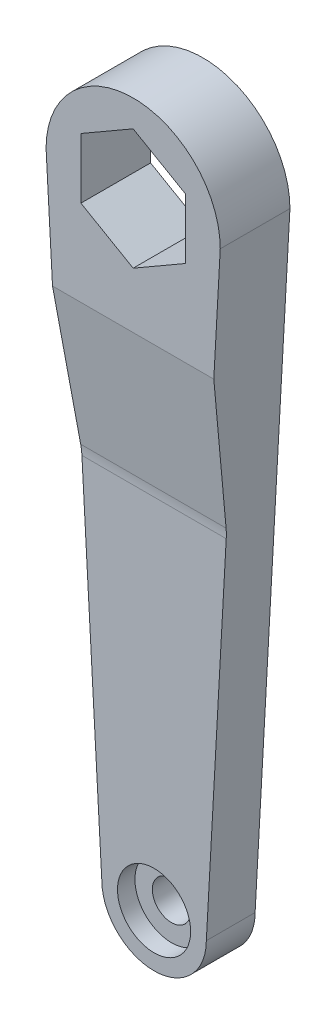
SolidWorks part; units mm, degrees
ref_plane "Plan de face" through (0, 0, 0) normal (0, 0, 1) x (1, 0, 0)
ref_plane "Plan de dessus" through (0, 0, 0) normal (0, 1, 0) x (1, 0, 0)
ref_plane "Plan de droite" through (0, 0, 0) normal (1, 0, 0) x (0, 0, -1)
sketch "Esquisse1" plane through (0, 0, 0) normal (0, 0, 1) x (1, 0, 0)
  line L0 (-12.5, 0) -> (-7.5, -90)
  line L1 (12.5, 0) -> (7.5, -90)
  line L3 (7.5, 4.3301) -> (0, 8.6603)
  line L4 (0, 8.6603) -> (-7.5, 4.3301)
  line L5 (-7.5, 4.3301) -> (-7.5, -4.3301)
  line L6 (-7.5, -4.3301) -> (0, -8.6603)
  line L7 (0, -8.6603) -> (7.5, -4.3301)
  line L8 (7.5, -4.3301) -> (7.5, 4.3301)
  arc A0 (12.5, 0) -> (-12.5, 0) centre (0, 0) ccw
  arc A1 (-7.5, -90) -> (7.5, -90) centre (0, -90) ccw
  circle A2 centre (0, 0) radius 7.5 construction
  circle A3 centre (0, -90) radius 2.75
  point P1 (7.5, 0)
  dimension "D2" = 25
  dimension "D3" = 15
  dimension "D5" = 5.5
  dimension "D1" = 90
  dimension "D4" = 15
extrude "Boss.-Extru.1" add sketch "Esquisse1" along normal blind 10
sketch "Esquisse2" plane through (0, 0, 0) normal (1, 0, 0) x (0, 0, -1)
  line L0 (-7, -117.102) -> (-7, -37.9025)
  line L1 (-7, -37.9025) -> (-11.9864, -2.5959)
  line L2 (-11.9864, -2.5959) -> (-24.582, -2.5959)
  line L3 (-24.582, -2.5959) -> (-24.582, -117.102)
  line L4 (-24.582, -117.102) -> (-7, -117.102)
  line L5 (0, -90) -> (0, 0) construction
  dimension "D1" = 7
extrude "Enlèv. mat.-Extru.1" cut sketch "Esquisse2" against normal through all and the other way through all
sketch "Esquisse3" plane through (0, 0, 7) normal (0, 0, 1) x (1, 0, 0)
  line L1 (0, -94.7343) -> (4.1, -92.3671)
  line L2 (4.1, -92.3671) -> (4.1, -87.6329)
  line L3 (4.1, -87.6329) -> (0, -85.2657)
  line L4 (0, -85.2657) -> (-4.1, -87.6329)
  line L5 (-4.1, -87.6329) -> (-4.1, -92.3671)
  line L6 (-4.1, -92.3671) -> (0, -94.7343)
  circle A0 centre (0, -90) radius 4.1 construction
  dimension "D1" = 8.2
fillet "Congé1" radius 10 1 edges at (0, -37.9025, 7)
sketch "Esquisse4" plane through (0, 0, 7) normal (0, 0, 1) x (1, 0, 0)
  circle A0 centre (0, -90) radius 5.25
  dimension "D1" = 10.5
extrude "Enlèv. mat.-Extru.3" cut sketch "Esquisse4" against normal blind 2.5
